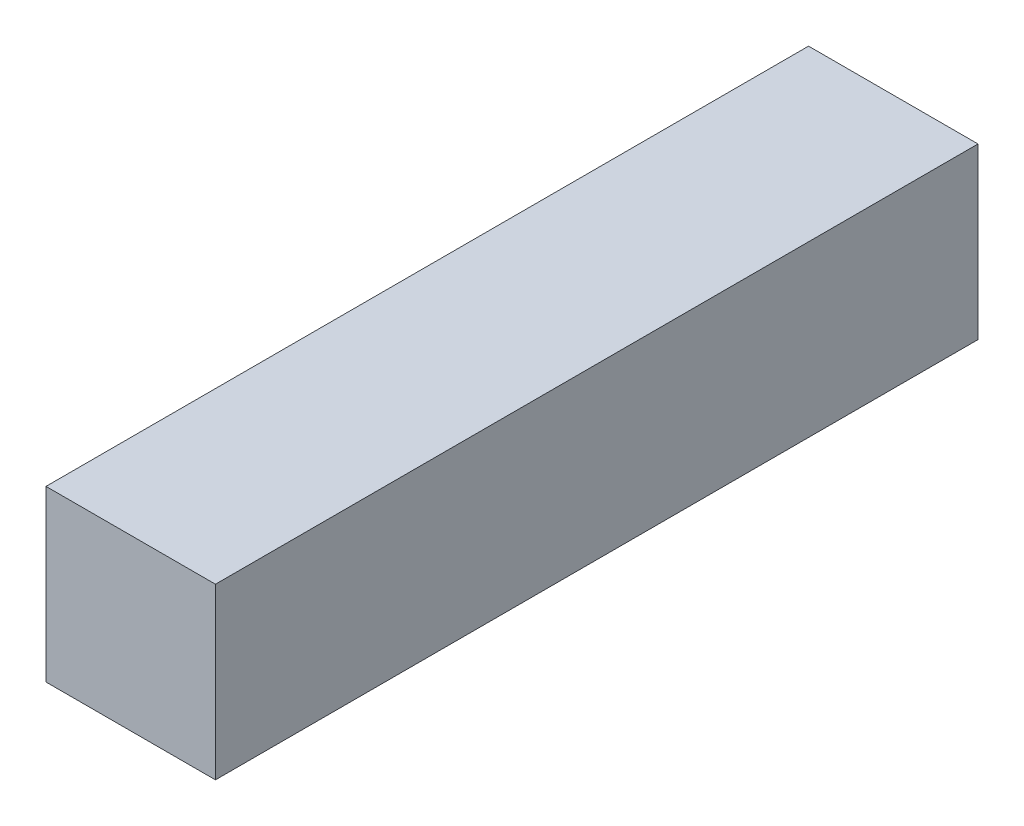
SolidWorks part; units mm, degrees
ref_plane "Face" through (0, 0, 0) normal (0, 0, 1) x (1, 0, 0)
ref_plane "Dessus" through (0, 0, 0) normal (0, 1, 0) x (1, 0, 0)
ref_plane "Droite" through (0, 0, 0) normal (1, 0, 0) x (0, 0, -1)
sketch "Esquisse1" plane through (0, 0, 0) normal (0, 0, 1) x (1, 0, 0)
  line L1 (0, 0) -> (20, 0)
  line L2 (0, 0) -> (0, 20)
  line L3 (0, 20) -> (20, 20)
  line L4 (20, 0) -> (20, 20)
  dimension "D1" = 20
extrude "Base-Extrusion" add sketch "Esquisse1" along normal blind 90
